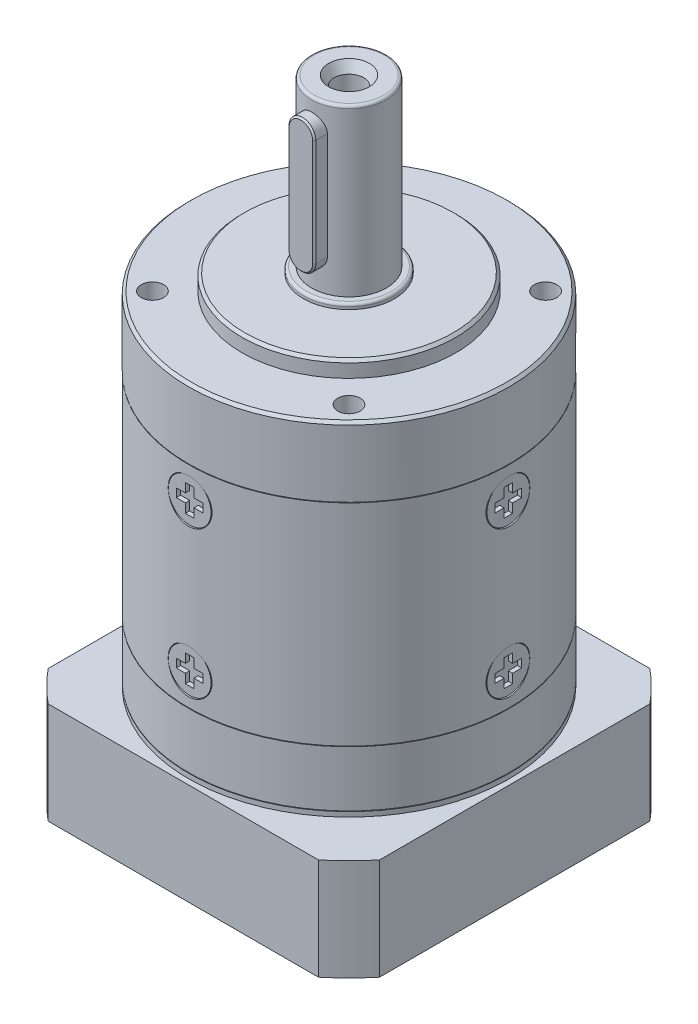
SolidWorks part; units mm, degrees
ref_plane "前视基准面" through (0, 0, 0) normal (0, 0, 1) x (1, 0, 0)
ref_plane "上视基准面" through (0, 0, 0) normal (0, 1, 0) x (1, 0, 0)
ref_plane "右视基准面" through (0, 0, 0) normal (1, 0, 0) x (0, 0, -1)
sketch "草图1" plane through (0, 0, 0) normal (0, 1, 0) x (1, 0, 0)
  circle A0 centre (0, 0) radius 20
extrude "凸台-拉伸1" add sketch "草图1" along normal blind 3
sketch "草图2" plane through (0, 0, 0) normal (0, -1, 0) x (1, 0, 0)
  circle A0 centre (0, 0) radius 30
extrude "凸台-拉伸2" add sketch "草图2" along normal blind 13
ref_plane "基准面1" through (0, -13.1, 0) normal (0, -1, 0) x (1, 0, 0)
sketch "草图3" plane through (0, -13.1, 0) normal (0, -1, 0) x (1, 0, 0)
  circle A0 centre (0, 0) radius 30
extrude "凸台-拉伸3" add sketch "草图3" along normal blind 39.4 separate body
ref_plane "基准面2" through (0, -52.6, 0) normal (0, -1, 0) x (1, 0, 0)
sketch "草图4" plane through (0, -52.6, 0) normal (0, -1, 0) x (1, 0, 0)
  circle A0 centre (0, 0) radius 30
extrude "凸台-拉伸4" add sketch "草图4" along normal blind 10.4 separate body
ref_plane "基准面3" through (0, -63.1, 0) normal (0, -1, 0) x (1, 0, 0)
sketch "草图5" plane through (0, -63.1, 0) normal (0, -1, 0) x (1, 0, 0)
  circle A0 centre (0, 0) radius 30
extrude "凸台-拉伸5" add sketch "草图5" along normal blind 0.9 separate body
sketch "草图6" plane through (0, -64, 0) normal (0, -1, 0) x (1, 0, 0)
  line L1 (-25.2784, 31) -> (25.2784, 31)
  line L2 (-31, 25.2784) -> (-31, -25.2784)
  line L3 (-25.2784, -31) -> (25.2784, -31)
  line L4 (31, 25.2784) -> (31, -25.2784)
  arc A0 (-25.2784, 31) -> (-31, 25.2784) centre (0, 0) ccw
  arc A1 (-31, -25.2784) -> (-25.2784, -31) centre (0, 0) ccw
  arc A2 (25.2784, -31) -> (31, -25.2784) centre (0, 0) ccw
  arc A3 (31, 25.2784) -> (25.2784, 31) centre (0, 0) ccw
  dimension "D1" = 31
  dimension "D3" = 31
extrude "凸台-拉伸6" add sketch "草图6" along normal blind 19
sketch "草图7" plane through (0, -83, 0) normal (0, -1, 0) x (1, 0, 0)
  circle A0 centre (0, 0) radius 25
extrude "切除-拉伸1" cut sketch "草图7" against normal blind 5
sketch "草图8" plane through (0, -78, 0) normal (0, -1, 0) x (1, 0, 0)
  circle A0 centre (0, 0) radius 17.5
extrude "切除-拉伸2" cut sketch "草图8" against normal blind 19
ref_plane "基准面4" through (0, -76, 0) normal (0, -1, 0) x (1, 0, 0)
sketch "草图9" plane through (0, -76, 0) normal (0, -1, 0) x (1, 0, 0)
  circle A0 centre (0, 0) radius 16
extrude "凸台-拉伸7" add sketch "草图9" against normal up to surface (17 mm away)
chamfer "倒角1" distance 1 angle 45 1 edges at (0, -76, -16)
sketch "草图10" plane through (0, -83, 0) normal (0, -1, 0) x (1, 0, 0)
  circle A0 centre (0, 0) radius 7
extrude "切除-拉伸3" cut sketch "草图10" against normal blind 32
sketch "草图11" plane through (0, -76, 0) normal (0, -1, 0) x (1, 0, 0)
  line L1 (-16.7216, 0.5) -> (16.9728, 0.5)
  line L2 (-16.7216, 0.5) -> (-16.7216, -0.5)
  line L3 (-16.7216, -0.5) -> (16.9728, -0.5)
  line L4 (16.9728, 0.5) -> (16.9728, -0.5)
  dimension "D1" = 0.5
  dimension "D2" = 1
extrude "切除-拉伸4" cut sketch "草图11" against normal up to surface (17 mm away)
chamfer "倒角2" distance 0.5 angle 45 1 edges at (0, 0, -30)
sketch "草图12" plane through (0, -83, 0) normal (0, -1, 0) x (1, 0, 0)
  line L0 (0, 0) -> (0, 25.5) construction
  line L1 (0, 0) -> (-12.75, 22.0836) construction
  circle A0 centre (0, 0) radius 25.5 construction
  circle A1 centre (-12.75, 22.0836) radius 4
  dimension "D1" = 30
extrude "切除-拉伸5" cut sketch "草图12" against normal blind 12
pattern_circular "阵列(圆周)1" count 4 over 360 about axis through (0, 0, 0) along (0, 1, 0) of "切除-拉伸5"
chamfer "倒角3" distance 0.5 angle 45 1 edges at (0, 3, 20)
sketch "草图13" plane through (0, -83, 0) normal (0, -1, 0) x (1, 0, 0)
  line L0 (0, 0) -> (-24.7487, -24.7487)
  circle A0 centre (0, 0) radius 35
hole_wizard "M4 螺纹孔1" positions "3D草图1" profile "草图14" tap size "M4" standard "GB"
sketch3d "3D草图1"
  point P0 (-24.7487, -83, -24.7487)
sketch "草图14" plane through (-24.7487, -83, -24.7487) normal (1, 0, 0) x (0, 0, -1)
  line L0 (0, 0) -> (0, 14.4914)
  line L1 (0, 14.4914) -> (1.65, 13.5)
  line L2 (1.65, 13.5) -> (1.65, 0)
  line L5 (1.65, 0) -> (0, 0)
  line L10 (0, 14.4914) -> (-1.65, 13.5) construction
  line L11 (0, -6.35) -> (0, 107.95) construction
  dimension "螺纹孔钻头直径" = 3.3
  dimension "螺纹孔钻头深度" = 13.5
  dimension "导头角度" = 118
pattern_circular "阵列(圆周)2" count 4 over 360 about axis through (0, 0, 0) along (0, 1, 0) of "M4 螺纹孔1"
sketch "草图15" plane through (0, 3, 0) normal (0, 1, 0) x (1, 0, 0)
  circle A0 centre (0, 0) radius 8.5
extrude "凸台-拉伸8" add sketch "草图15" along normal blind 1
sketch "草图16" plane through (0, 4, 0) normal (0, 1, 0) x (1, 0, 0)
  circle A0 centre (0, 0) radius 7
extrude "凸台-拉伸9" add sketch "草图16" along normal blind 31
fillet "圆角1" radius 0.5 1 edges at (0, 4, 8.5)
fillet "圆角2" radius 0.5 1 edges at (0, 35, 7)
sketch "草图17" plane through (0, 0, 0) normal (0, 1, 0) x (1, 0, 0)
  line L0 (0, 0) -> (-28.2843, 28.2843)
  circle A0 centre (0, 0) radius 26
  arc A1 (-25.2784, 31) -> (-31, 25.2784) centre (0, 0) ccw construction
hole_wizard "M5 螺纹孔1" positions "3D草图2" profile "草图18" tap size "M5" standard "GB"
sketch3d "3D草图2"
  line L0 (0, 0, 0) -> (-28.2843, 0, -28.2843) construction
  circle A0 centre (0, 0, 0) radius 26 construction
  point P0 (-18.3848, 0, -18.3848)
  point P6 (0, 26, 0)
sketch "草图18" plane through (-18.3848, 0, -18.3848) normal (1, 0, 0) x (0, 0, 1)
  line L0 (0, 0) -> (0, 15.2618)
  line L1 (0, 15.2618) -> (2.1, 14)
  line L2 (2.1, 14) -> (2.1, 0)
  line L5 (2.1, 0) -> (0, 0)
  line L10 (0, 15.2618) -> (-2.1, 14) construction
  line L11 (0, -6.35) -> (0, 107.95) construction
  dimension "螺纹孔钻头直径" = 4.2
  dimension "螺纹孔钻头深度" = 14
  dimension "导头角度" = 118
pattern_circular "阵列(圆周)4" count 4 over 360 about axis through (0, 0, 0) along (0, 1, 0) of "M5 螺纹孔1"
ref_plane "基准面5" through (0, 0, 30) normal (0, 0, 1) x (1, 0, 0)
ref_plane "基准面6" through (0, 0, 29) normal (0, 0, 1) x (1, 0, 0)
sketch "草图19" plane through (0, 0, 29) normal (0, 0, 1) x (1, 0, 0)
  line L0 (-30, -13) -> (30, -13) construction
  line L1 (30, -52.6) -> (-30, -52.6) construction
  circle A0 centre (0, -19) radius 4.1
  circle A1 centre (0, -46.6) radius 4.1
  dimension "D1" = 6
  dimension "D2" = 6
extrude "切除-拉伸6" cut sketch "草图19" along normal blind 31
pattern_circular "阵列(圆周)5" count 4 over 360 about axis through (0, 0, 0) along (0, 1, 0) of "切除-拉伸6"
sketch "草图20" plane through (0, 0, 29) normal (0, 0, 1) x (1, 0, 0)
  line L0 (0.8, -19.8) -> (0.8, -21.5)
  line L1 (-0.8, -16.5) -> (0.8, -16.5)
  line L2 (-0.8, -16.5) -> (-0.8, -18.2)
  line L3 (-0.8, -21.5) -> (0.8, -21.5)
  line L4 (0.8, -16.5) -> (0.8, -18.2)
  line L5 (-2.5, -18.2) -> (-0.8, -18.2)
  line L6 (-2.5, -18.2) -> (-2.5, -19.8)
  line L7 (-2.5, -19.8) -> (-0.8, -19.8)
  line L8 (2.5, -18.2) -> (2.5, -19.8)
  line L9 (-0.8, -19.8) -> (-0.8, -21.5)
  line L10 (0.8, -18.2) -> (2.5, -18.2)
  line L11 (0.8, -19.8) -> (2.5, -19.8)
  line L12 (0.8, -47.4) -> (0.8, -49.1)
  line L13 (-2.5, -45.8) -> (-0.8, -45.8)
  line L14 (-2.5, -45.8) -> (-2.5, -47.4)
  line L15 (-2.5, -47.4) -> (-0.8, -47.4)
  line L16 (2.5, -45.8) -> (2.5, -47.4)
  line L17 (-0.8, -44.1) -> (0.8, -44.1)
  line L18 (-0.8, -44.1) -> (-0.8, -45.8)
  line L19 (-0.8, -49.1) -> (0.8, -49.1)
  line L20 (0.8, -44.1) -> (0.8, -45.8)
  line L21 (-0.8, -47.4) -> (-0.8, -49.1)
  line L22 (0.8, -45.8) -> (2.5, -45.8)
  line L23 (0.8, -47.4) -> (2.5, -47.4)
  circle A0 centre (0, -19) radius 4
  circle A1 centre (0, -46.6) radius 4
  dimension "D1" = 0.8
  dimension "D9" = 0.8
  dimension "D2" = 1.6
  dimension "D3" = 0.8
  dimension "D4" = 1.6
  dimension "D5" = 2.5
  dimension "D6" = 5
  dimension "D7" = 2.5
  dimension "D8" = 5
  dimension "D10" = 1.6
  dimension "D11" = 0.8
  dimension "D12" = 1.6
  dimension "D13" = 2.5
  dimension "D14" = 5
  dimension "D15" = 2.5
  dimension "D16" = 5
extrude "凸台-拉伸10" add sketch "草图20" along normal blind 0.8
pattern_circular "阵列(圆周)21" count 4 over 360 about axis through (0, 0, 0) along (0, 1, 0) of "凸台-拉伸10"
sketch "草图21" plane through (0, -71, 0) normal (0, -1, 0) x (1, 0, 0)
  line L1 (-11.8663, 23.5733) -> (-13.5983, 23.5938)
  line L2 (-13.5983, 23.5938) -> (-14.4819, 22.1041)
  line L3 (-14.4819, 22.1041) -> (-13.6337, 20.594)
  line L4 (-13.6337, 20.594) -> (-11.9017, 20.5735)
  line L5 (-11.9017, 20.5735) -> (-11.0181, 22.0632)
  line L6 (-11.0181, 22.0632) -> (-11.8663, 23.5733)
  circle A0 centre (-12.75, 22.0836) radius 3.5
  circle A1 centre (-12.75, 22.0836) radius 1.5 construction
  dimension "D1" = 3
extrude "凸台-拉伸11" add sketch "草图21" along normal blind 4
pattern_circular "阵列(圆周)22" count 4 over 360 about axis through (0, 0, 0) along (0, 1, 0) of "凸台-拉伸11"
sketch "草图22" plane through (0, 0, 0) normal (0, 0, 1) x (1, 0, 0)
  line L0 (6.5, 35) -> (-6.5, 35) construction
  line L1 (-2.5, 30) -> (-2.5, 10)
  line L2 (2.5, 30) -> (2.5, 10)
  arc A0 (2.5, 30) -> (-2.5, 30) centre (0, 30) ccw
  arc A1 (-2.5, 10) -> (2.5, 10) centre (0, 10) ccw
  dimension "D1" = 5
  dimension "D2" = 20
extrude "凸台-拉伸12" add sketch "草图22" along normal blind 9
chamfer "倒角4" distance 0.3 angle 45 4 edges at (-2.5, 20, 9) (0, 7.5, 9) (0, 32.5, 9) (2.5, 20, 9)
sketch "草图23" plane through (0, 35, 0) normal (0, 1, 0) x (1, 0, 0)
  circle A0 centre (0, 0) radius 2.75
extrude "切除-拉伸7" cut sketch "草图23" against normal blind 4.8
sketch "草图24" plane through (0, 35, 0) normal (0, 1, 0) x (1, 0, 0)
  circle A0 centre (0, 0) radius 3.8
ref_plane "基准面7" through (0, 33.2, 0) normal (0, 1, 0) x (-1, 0, 0)
sketch "草图25" plane through (0, 33.2, 0) normal (0, 1, 0) x (-1, 0, 0)
  circle A0 centre (0, 0) radius 2.75 construction
  circle A1 centre (0, 0) radius 2.75
loft "切除-放样1" cut profiles "草图24", "草图25"
hole_wizard "M5 螺纹孔2" positions "3D草图3" profile "草图26" tap size "M5" standard "GB"
sketch3d "3D草图3"
  line L0 (0, 30.2, 0) -> (0, 33.2, 0) construction
  point P0 (0, 30.2, 0)
sketch "草图26" plane through (0, 30.2, 0) normal (1, 0, 0) x (0, 0, 1)
  line L0 (0, 0) -> (0, 11.2618)
  line L1 (0, 11.2618) -> (2.1, 10)
  line L2 (2.1, 10) -> (2.1, 0)
  line L5 (2.1, 0) -> (0, 0)
  line L10 (0, 11.2618) -> (-2.1, 10) construction
  line L11 (0, -6.35) -> (0, 107.95) construction
  dimension "螺纹孔钻头直径" = 4.2
  dimension "螺纹孔钻头深度" = 10
  dimension "导头角度" = 118
